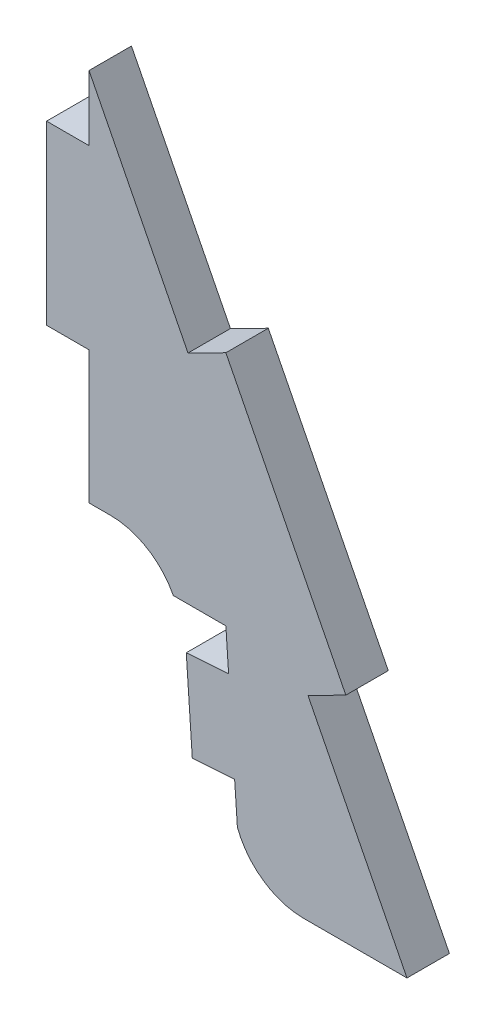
SolidWorks part; units mm, degrees
ref_plane "Front Plane" through (0, 0, 0) normal (0, 0, 1) x (1, 0, 0)
ref_plane "Top Plane" through (0, 0, 0) normal (0, 1, 0) x (1, 0, 0)
ref_plane "Right Plane" through (0, 0, 0) normal (1, 0, 0) x (0, 0, -1)
sketch "Sketch1" plane through (0, 0, 0) normal (0, 0, 1) x (1, 0, 0)
  line L0 (1.524, -263.8691) -> (0, -263.8691)
  line L1 (0, -263.8691) -> (0, -257.5191)
  line L2 (0, -257.5191) -> (1.524, -257.5191)
  line L3 (1.524, -257.5191) -> (1.524, -255.1827)
  line L4 (1.524, -255.1827) -> (5.0789, -262.192)
  line L5 (12.9422, -277.6963) -> (9.2287, -277.6963)
  line L6 (1.524, -268.6316) -> (1.524, -263.8691)
  line L7 (6.8516, -276.0513) -> (6.753, -274.6082)
  line L8 (9.3873, -270.6869) -> (10.7465, -269.9976)
  line L9 (5.0789, -262.192) -> (6.4381, -261.5027)
  line L10 (6.4381, -269.9976) -> (4.5527, -269.9976)
  line L11 (10.7465, -269.9976) -> (6.4381, -261.5027)
  line L12 (9.3873, -270.6869) -> (12.9422, -277.6963)
  line L13 (6.5367, -271.4406) -> (6.4381, -269.9976)
  line L14 (1.524, -268.6316) -> (2.3004, -268.6316)
  line L15 (6.5367, -271.4406) -> (5.0162, -271.5445)
  line L16 (6.753, -274.6082) -> (5.2326, -274.7121)
  line L18 (5.0162, -271.5445) -> (5.2326, -274.7121)
  arc A0 (6.8516, -276.0513) -> (9.2287, -277.6963) centre (9.2287, -275.1563) ccw
  arc A1 (2.3004, -268.6316) -> (4.5527, -269.9976) centre (2.3004, -271.1716) cw
extrude "Boss-Extrude1" add sketch "Sketch1" along normal blind 1.524
